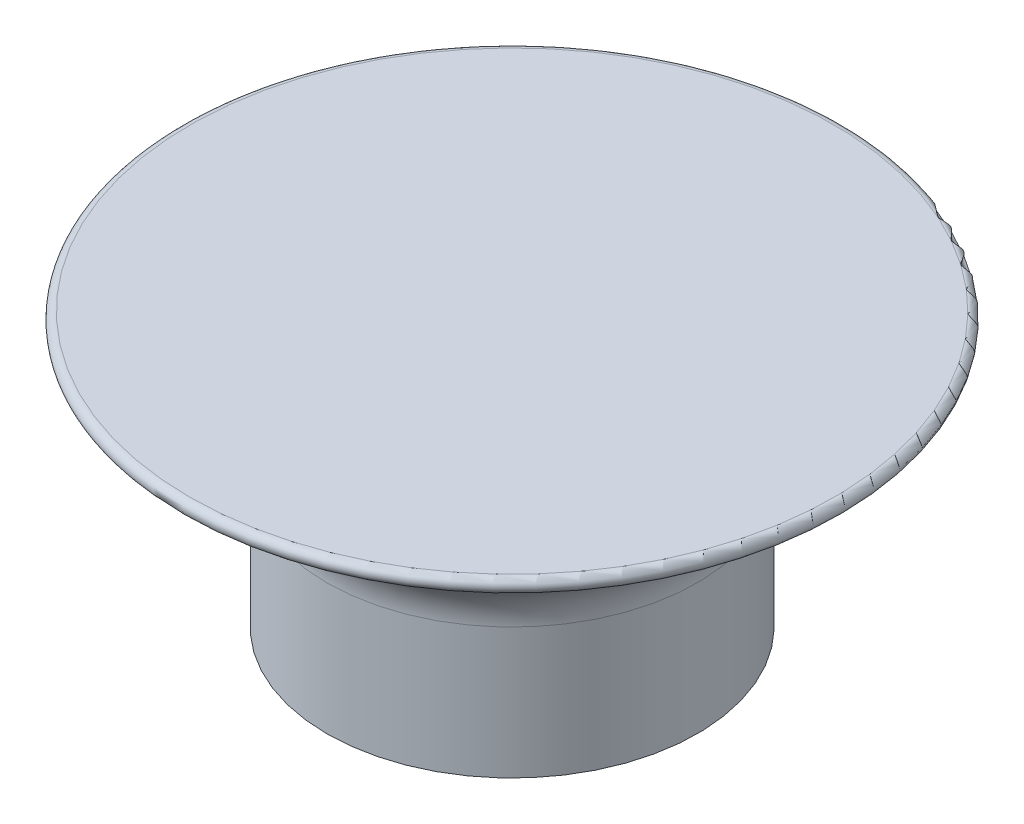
SolidWorks part; units mm, degrees
ref_plane "Front Plane" through (0, 0, 0) normal (0, 0, 1) x (1, 0, 0)
ref_plane "Top Plane" through (0, 0, 0) normal (0, 1, 0) x (1, 0, 0)
ref_plane "Right Plane" through (0, 0, 0) normal (1, 0, 0) x (0, 0, -1)
sketch "Sketch1" plane through (0, 0, 0) normal (0, 1, 0) x (1, 0, 0)
  circle A0 centre (0, 0) radius 3.937
  circle A1 centre (0, 0) radius 7.747
  dimension "D1" = 7.874
  dimension "D2" = 3.81
extrude "Boss-Extrude1" add sketch "Sketch1" along normal blind 6.35
ref_plane "Plane1" through (0, 11.43, 0) normal (0, 1, 0) x (1, 0, 0)
sketch "Sketch2" plane through (0, 11.43, 0) normal (0, 1, 0) x (1, 0, 0)
  circle A0 centre (0, 0) radius 14.605
  dimension "D1" = 29.21
sketch "Sketch3" plane through (0, 6.35, 0) normal (0, 1, 0) x (1, 0, 0)
  circle A0 centre (0, 0) radius 7.747 construction
  circle A1 centre (0, 0) radius 7.747
loft "Loft1" add profiles "Sketch3", "Sketch2"
fillet "Fillet1" radius 0.3048 1 edges at (0, 11.43, 14.605)
fillet "Fillet2" radius 2.54 1 edges at (0, 6.35, 7.747)
